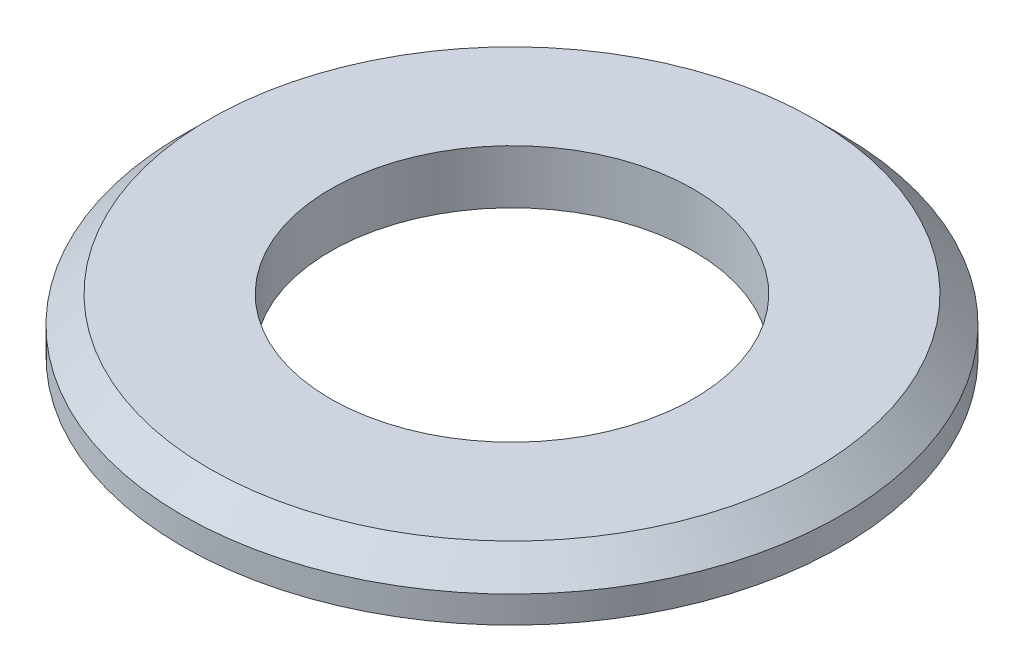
SolidWorks part; units mm, degrees
ref_plane "Front" through (0, 0, 0) normal (0, 0, 1) x (1, 0, 0)
ref_plane "Top" through (0, 0, 0) normal (0, 1, 0) x (1, 0, 0)
ref_plane "Right" through (0, 0, 0) normal (1, 0, 0) x (0, 0, -1)
sketch "Sketch1" plane through (0, 0, 0) normal (0, 1, 0) x (1, 0, 0)
  circle A0 centre (0, 0) radius 27
  circle A1 centre (0, 0) radius 49
extrude "Extrude1" add sketch "Sketch1" along normal blind 8
chamfer "Chamfer1" distance 4 1 edges at (0, 8, 49)
